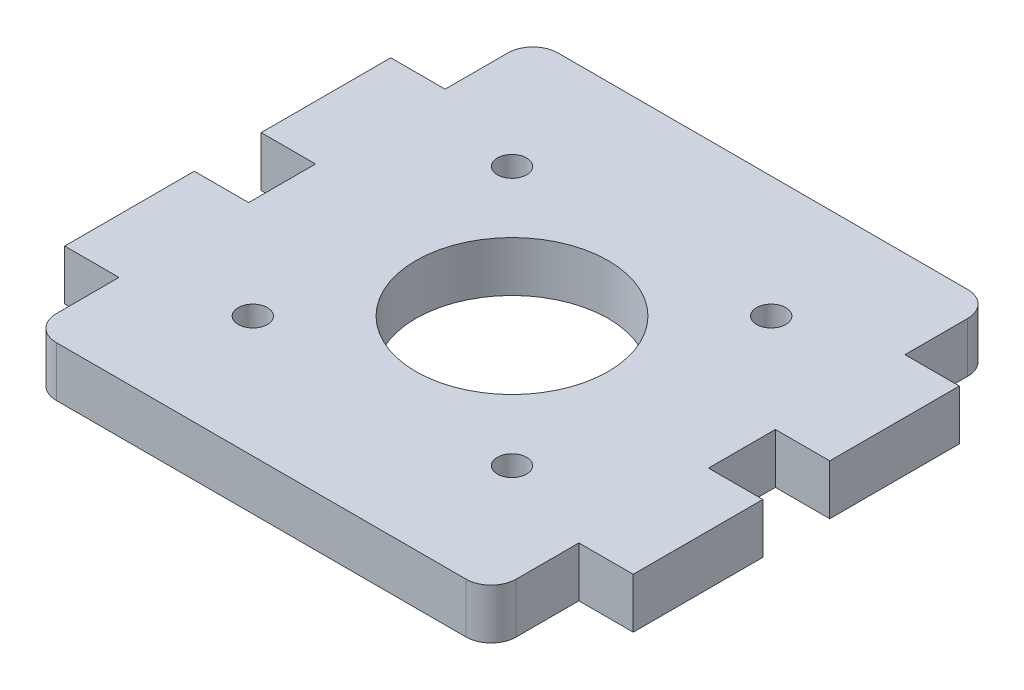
SolidWorks part; units mm, degrees
ref_plane "Front Plane" through (0, 0, 0) normal (0, 0, 1) x (1, 0, 0)
ref_plane "Top Plane" through (0, 0, 0) normal (0, 1, 0) x (1, 0, 0)
ref_plane "Right Plane" through (0, 0, 0) normal (1, 0, 0) x (0, 0, -1)
sketch "Sketch1" plane through (0, 0, 0) normal (0, 1, 0) x (1, 0, 0)
  line L3 (0, 0) -> (0, 35) construction
  line L6 (-27.5, -30) -> (27.5, -30)
  line L22 (0, 25.5) -> (0, 50025.5) construction
  line L24 (-27.5, -30) -> (-27.5, -19.5)
  line L25 (-27.5, 30) -> (27.5, 30)
  line L26 (27.5, -30) -> (27.5, -19.5)
  line L27 (0, 0) -> (-50000, 0) construction
  line L29 (27.5, 19.5) -> (34, 19.5)
  line L31 (27.5, 4) -> (34, 4)
  line L32 (34, 19.5) -> (34, 4)
  line L33 (27.5, -4) -> (27.5, 4)
  line L37 (34, -19.5) -> (34, -4)
  line L38 (27.5, -4) -> (34, -4)
  line L40 (27.5, -19.5) -> (34, -19.5)
  line L41 (27.5, 19.5) -> (27.5, 30)
  line L43 (-27.5, -4) -> (-27.5, 4)
  line L45 (-27.5, -19.5) -> (-34, -19.5)
  line L47 (-27.5, -4) -> (-34, -4)
  line L48 (-34, -19.5) -> (-34, -4)
  line L49 (-34, 19.5) -> (-34, 4)
  line L50 (-27.5, 4) -> (-34, 4)
  line L52 (-27.5, 19.5) -> (-34, 19.5)
  line L53 (-27.5, 19.5) -> (-27.5, 30)
  circle A0 centre (0, 0) radius 11.5
  circle A1 centre (15.5, 15.5) radius 1.75
  circle A2 centre (-15.5, 15.5) radius 1.75
  circle A3 centre (15.5, -15.5) radius 1.75
  circle A4 centre (-15.5, -15.5) radius 1.75
  point P7 (27.5, 13.5)
  point P14 (0, 30)
  point P16 (-9.8117, 35.7831)
  point P40 (27.5, -13.5)
  point P49 (-27.5, -13.5)
  dimension "D1" = 23
  dimension "D3" = 6.5
  dimension "D7" = 3.5
  dimension "D9" = 31
  dimension "D4" = 30
  dimension "D6" = 30
  dimension "D8" = 55
  dimension "D10" = 31
  dimension "D11" = 4
  dimension "D13" = 15.5
  dimension "D15" = 30
  dimension "D20" = 180
  dimension "D5" = 30
extrude "Boss-Extrude1" add sketch "Sketch1" along normal mid plane 6
fillet "Fillet1" radius 3 4 edges at (-27.5, 0, -30) (-27.5, 0, 30) (27.5, 0, 30) (27.5, 0, -30)
